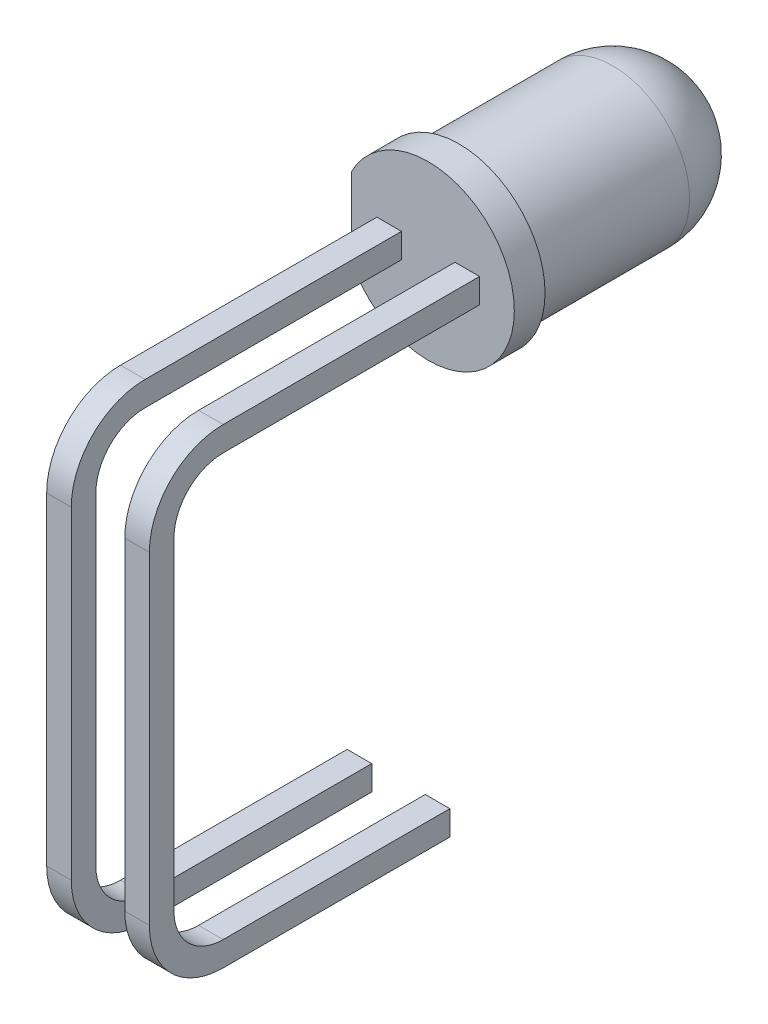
SolidWorks part; units mm, degrees
ref_plane "Face" through (0, 0, 0) normal (0, 0, 1) x (1, 0, 0)
ref_plane "Dessus" through (0, 0, 0) normal (0, 1, 0) x (1, 0, 0)
ref_plane "Droite" through (0, 0, 0) normal (1, 0, 0) x (0, 0, -1)
sketch "Esquisse1" plane through (0, 0, 0) normal (0, 0, 1) x (1, 0, 0)
  circle A0 centre (0, 0) radius 2.5
extrude "Base-Extrusion" add sketch "Esquisse1" along normal blind 8.5
sketch "Esquisse2" plane through (0, 0, 8.5) normal (0, 0, 1) x (1, 0, 0)
  line L0 (2.5, -2.4917) -> (2.5, 2.5621) construction
  line L2 (-2.5, 1.261) -> (-2.5, -1.261)
  arc A0 (-2.5, -1.261) -> (-2.5, 1.261) centre (0, 0) ccw
extrude "Boss.-Extru.1" add sketch "Esquisse2" against normal blind 1
fillet "Congé1" radius 2.5 1 edges at (2.5, 0, 0)
ref_plane "Plan1" through (1.27, 0, 0) normal (1, 0, 0) x (0, 0, -1)
ref_plane "Plan2" through (-1.27, 0, 0) normal (1, 0, 0) x (0, 0, -1)
sketch "Esquisse6" plane through (1.27, 0, 0) normal (1, 0, 0) x (0, 0, -1)
  line L0 (-8.5, 0) -> (-16.84, 0)
  line L1 (-18.84, -2) -> (-18.84, -12.5079)
  line L2 (-16.84, -14.5079) -> (-9.4662, -14.5079)
  line L3 (-8.5, 2.8) -> (-8.5, -2.8) construction
  arc A0 (-16.84, 0) -> (-18.84, -2) centre (-16.84, -2) ccw
  arc A1 (-18.84, -12.5079) -> (-16.84, -14.5079) centre (-16.84, -12.5079) ccw
  dimension "D1" = 2
sketch "Esquisse7" plane through (0, 0, 8.5) normal (0, 0, 1) x (1, 0, 0)
  line L1 (-2.8363, 0.4) -> (3.2725, 0.4) construction
  line L2 (-2.8363, -0.4) -> (3.5179, -0.4) construction
  line L3 (0, 1.7391) -> (0, -2.297) construction
  line L4 (0.87, 0.4) -> (1.67, 0.4)
  line L7 (0.87, 0.4) -> (0.87, -0.4)
  line L8 (1.67, 0.4) -> (1.67, -0.4)
  line L9 (0.87, -0.4) -> (1.67, -0.4)
sweep "Balayage6" add profiles "Esquisse7" path "Esquisse6"
sketch "Esquisse8" plane through (0, 0, 8.5) normal (0, 0, 1) x (1, 0, 0)
  line L0 (-3.7009, 0.902) -> (4.9187, 0.902)
pattern_linear "Répétition linéaire1" count 2 spacing 2.54 along (-1, 0, 0) of "Balayage6"
